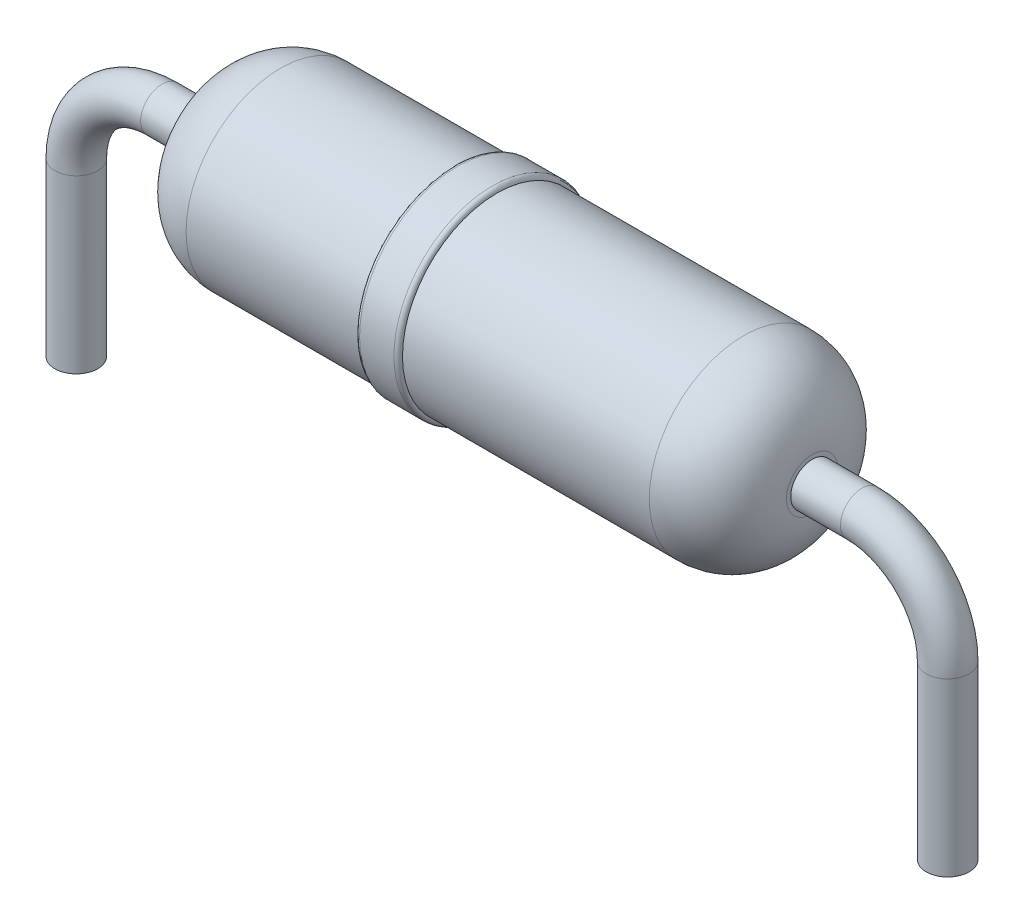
SolidWorks part; units mm, degrees
ref_plane "Face" through (0, 0, 0) normal (0, 0, 1) x (1, 0, 0)
ref_plane "Dessus" through (0, 0, 0) normal (0, 1, 0) x (1, 0, 0)
ref_plane "Droite" through (0, 0, 0) normal (1, 0, 0) x (0, 0, -1)
sketch "Esquisse1" plane through (0, 0, 0) normal (0, 0, 1) x (1, 0, 0)
  line L0 (-54.2687, 0) -> (62.1733, 0) construction
  line L1 (-48.4922, 1.1) -> (45.7559, 1.1) construction
  line L2 (-3.5, -1.6411) -> (-3.5, 4.3175) construction
  line L3 (0, -1.0268) -> (0, 4.1947) construction
  line L4 (3.5, 3.6009) -> (3.5, -1.9687) construction
  line L5 (-3.5, 0) -> (-3.5, 0.3)
  line L6 (-2.7, 1.1) -> (2.7, 1.1)
  line L7 (3.5, 0.3) -> (3.5, 0)
  line L8 (3.5, 0) -> (-3.5, 0)
  arc A0 (-2.7, 1.1) -> (-3.5, 0.3) centre (-2.7, 0.3) ccw
  arc A1 (3.5, 0.3) -> (2.7, 1.1) centre (2.7, 0.3) ccw
revolve "Base-Révolution" add sketch "Esquisse1" angle 360 about L0
sketch "Esquisse2" plane through (0, 0, 0) normal (0, 0, 1) x (1, 0, 0)
  line L0 (-3.3896, 1.15) -> (3.161, 1.15) construction
  line L1 (-2, 1.3889) -> (-2, -0.1179) construction
  line L2 (-1.5, 1.4925) -> (-1.5, -0.2136) construction
  line L3 (4.3262, 0) -> (-3.8651, 0) construction
  line L6 (-0.677, 1.15) -> (-0.677, 0)
  line L9 (-0.177, 1.15) -> (-0.177, 0)
  line L12 (-0.677, 0) -> (-0.177, 0)
  line L13 (-0.677, 1.15) -> (-0.177, 1.15)
revolve "Boss.-Révol.1" add sketch "Esquisse2" angle 360 about L3
fillet "Congé1" radius 0.05 2 edges at (-0.177, 0, -1.15) (-0.677, 0, -1.15)
sketch "Esquisse3" plane through (-3.5, 0, 0) normal (-1, 0, 0) x (0, 0, 1)
  circle A0 centre (0, 0) radius 0.25
sketch "Esquisse4" plane through (0, 0, 0) normal (0, 0, 1) x (1, 0, 0)
  line L0 (-3.1075, 0) -> (-5.8186, 0) construction
  line L1 (0, -2.524) -> (0, 3.2043) construction
  line L2 (-5.9326, -3) -> (3.6667, -3) construction
  line L3 (-5.08, 1.6795) -> (-5.08, -3.4934) construction
  line L4 (-3.08, 0) -> (-4.08, 0)
  line L5 (-5.08, -1) -> (-5.08, -3)
  arc A0 (-4.08, 0) -> (-5.08, -1) centre (-4.08, -1) ccw
  dimension "D1" = 3
  dimension "D2" = 5.08
sweep "Balayage1" add profiles "Esquisse3" path "Esquisse4"
ref_plane "Plan1" through (0, 0, 0) normal (1, 0, 0) x (0, 0, -1)
mirror "Symétrie1" about plane through (0, 0, 0) normal (1, 0, 0) of "Balayage1"
